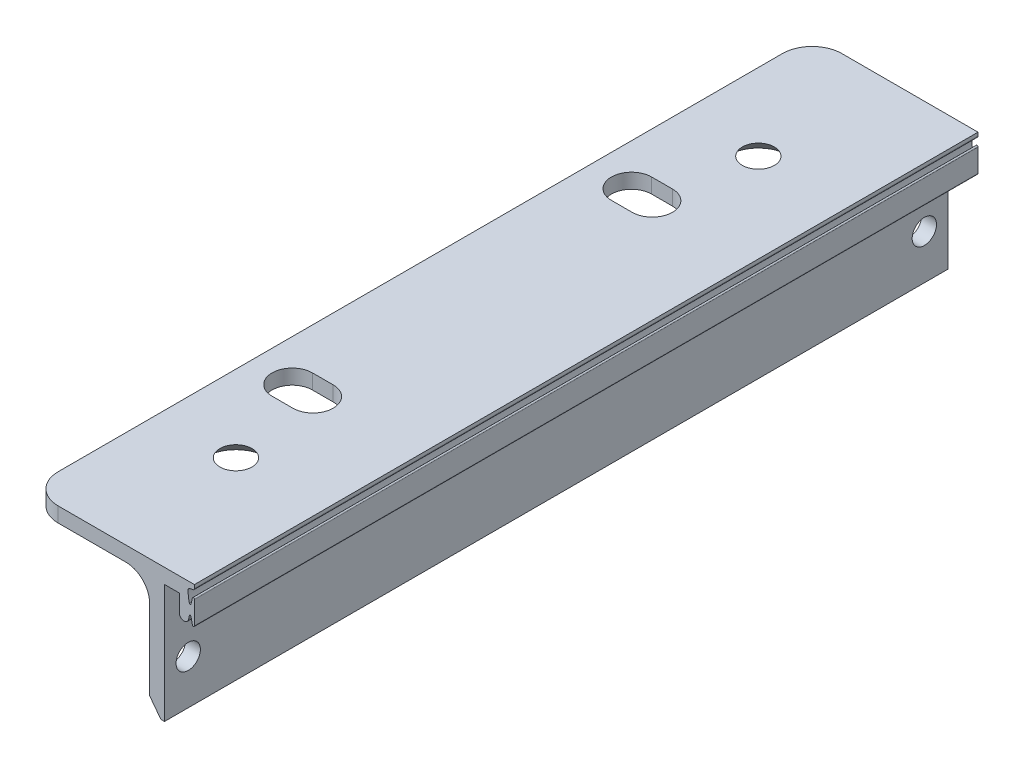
SolidWorks part; units mm, degrees
ref_plane "前视基准面" through (0, 0, 0) normal (0, 0, 1) x (1, 0, 0)
ref_plane "上视基准面" through (0, 0, 0) normal (0, 1, 0) x (1, 0, 0)
ref_plane "右视基准面" through (0, 0, 0) normal (1, 0, 0) x (0, 0, -1)
sketch "草图1" plane through (0, 0, 0) normal (0, 0, 1) x (1, 0, 0)
  line L0 (2329.984, -3290.1038) -> (2357.924, -3290.1038)
  line L1 (2329.984, -3292.6038) -> (2350.384, -3292.6038)
  line L2 (2352.884, -3292.6038) -> (2355.384, -3292.6038)
  line L3 (2350.384, -3292.6038) -> (2350.384, -3310.1038)
  line L4 (2352.884, -3292.6038) -> (2352.884, -3312.6038)
  line L6 (2357.924, -3290.1038) -> (2357.924, -3290.6784)
  line L8 (2329.984, -3290.1038) -> (2329.984, -3292.6038)
  line L9 (2355.384, -3292.6038) -> (2355.384, -3295.5205)
  line L10 (2352.884, -3312.6038) -> (2352.284, -3312.6038)
  line L11 (2350.384, -3310.1038) -> (2352.284, -3312.6038)
  line L14 (2356.9332, -3295.6826) -> (2357.0658, -3295.056)
  line L15 (2357.924, -3292.2796) -> (2357.924, -3296.128)
  line L17 (2357.1229, -3291.0635) -> (2357.672, -3290.9746)
  line L18 (2357.3611, -3295.0491) -> (2357.5873, -3296.1683)
  line L19 (2357.5884, -3292.2343) -> (2357.3601, -3293.2128)
  arc A0 (2356.8711, -3291.3476) -> (2357.0651, -3293.1963) centre (2363.3121, -3291.6063) ccw
  arc A1 (2357.672, -3290.9746) -> (2357.924, -3290.6784) centre (2357.624, -3290.6784) ccw
  arc A2 (2357.1229, -3291.0635) -> (2356.8711, -3291.3476) centre (2357.1709, -3291.3596) ccw
  arc A3 (2357.3611, -3295.0491) -> (2357.0658, -3295.056) centre (2357.214, -3295.0788) ccw
  arc A4 (2357.5873, -3296.1683) -> (2357.924, -3296.128) centre (2357.754, -3296.1346) ccw
  arc A5 (2357.0651, -3293.1963) -> (2357.3601, -3293.2128) centre (2357.214, -3293.1788) ccw
  arc A6 (2357.924, -3292.2796) -> (2357.5884, -3292.2343) centre (2357.754, -3292.2729) ccw
  arc A7 (2355.384, -3295.5205) -> (2356.9332, -3295.6826) centre (2356.1671, -3295.5205) ccw
  dimension "D1" = 20
  dimension "D2" = 0.6
  dimension "D3" = 2.5
  dimension "D4" = 20.4
  dimension "D5" = 127.235
extrude "凸台-拉伸1" add sketch "草图1" along normal mid plane 132
sketch "草图2" plane through (0, -3290.1038, 0) normal (0, 1, 0) x (1, 0, 0)
  line L0 (2338.734, 31.975) -> (2338.734, 25.175) construction
  line L2 (2357.924, 66) -> (2329.984, 66) construction
  line L3 (2357.924, 0) -> (2329.984, 0) construction
  line L4 (2357.924, -66) -> (2357.924, 66) construction
  line L5 (2329.984, -66) -> (2329.984, 66) construction
  line L6 (2340.484, -25.175) -> (2336.984, -25.175)
  line L7 (2340.484, -31.975) -> (2336.984, -31.975)
  line L9 (2340.484, 31.975) -> (2336.984, 31.975)
  line L10 (2340.484, 25.175) -> (2336.984, 25.175)
  arc A0 (2336.984, -31.975) -> (2336.984, -25.175) centre (2336.984, -28.575) cw
  arc A1 (2336.984, 31.975) -> (2336.984, 25.175) centre (2336.984, 28.575) ccw
  arc A2 (2340.484, -25.175) -> (2340.484, -31.975) centre (2340.484, -28.575) cw
  arc A4 (2340.484, 25.175) -> (2340.484, 31.975) centre (2340.484, 28.575) ccw
  dimension "D4" = 8.75
  dimension "D1" = 37.425
  dimension "D5" = 3.5
  dimension "D6" = 3.4
extrude "切除-拉伸1" cut sketch "草图2" against normal through all
sketch "草图3" plane through (2350.384, 0, 0) normal (-1, 0, 0) x (0, 0, 1)
  line L0 (-66, -3292.6038) -> (-66, -3310.1038) construction
  line L1 (66, -3290.1038) -> (-66, -3290.1038) construction
  line L2 (0, -3290.1038) -> (0, -3328.2905) construction
  circle A0 centre (-62, -3305.1038) radius 2.05
  circle A1 centre (62, -3305.1038) radius 2.05
  circle A2 centre (-62, -3325.1038) radius 2.05
  circle A3 centre (62, -3325.1038) radius 2.05
  dimension "D1" = 4.1
  dimension "D2" = 4
  dimension "D3" = 15
  dimension "D4" = 2
extrude "切除-拉伸2" cut sketch "草图3" against normal through all
fillet "圆角1" radius 5 2 edges at (2329.984, -3291.3538, -66) (2329.984, -3291.3538, 66)
hole_wizard "M5 平头机械螺钉的锥形沉头孔1" positions "草图5" profile "草图4" countersink size "M5" standard "Ansi Metric"
sketch "草图5" plane through (0, -3292.6038, 0) normal (0, -1, 0) x (-1, 0, 0)
  line L0 (-2329.984, 0) -> (-2357.9242, 0) construction
  line L1 (-2329.984, -61) -> (-2329.984, 61) construction
  line L2 (-2357.9242, 66) -> (-2357.9242, -66) construction
  point P0 (-2342.9242, -44)
  point P2 (-2342.9242, 44)
  dimension "D1" = 88
  dimension "D2" = 44
  dimension "D3" = 15
sketch "草图4" plane through (2342.9242, -3292.6038, 44) normal (1, 0, 0) x (0, 0, -1)
  line L0 (0, 0) -> (0, 2.5)
  line L1 (0, 2.5) -> (2.65, 2.5)
  line L2 (2.65, 2.5) -> (2.65, 2.55)
  line L3 (2.65, 2.55) -> (5.2, 0)
  line L5 (5.2, 0) -> (0, 0)
  line L6 (-2.65, 2.55) -> (-5.2, 0) construction
  line L11 (0, -6.35) -> (0, 107.95) construction
  dimension "通孔孔直径" = 5.3
  dimension "通孔孔深度" = 2.5
  dimension "近端锥形沉头孔直径" = 10.4
  dimension "近端锥形沉头孔角度" = 90
fillet "圆角2" radius 4 1 edges at (2350.384, -3292.6038, 0)
equation "\"切除-拉伸3\" = if ( \"D1@凸台-拉伸1\" = 176.45 , \"unsuppressed\" , \"suppressed\" )"
equation "\"切除-拉伸4\" = if ( \"D1@凸台-拉伸1\" = 220.9 , \"unsuppressed\" , \"suppressed\" )"
equation "\"切除-拉伸5\" = if ( \"D1@凸台-拉伸1\" = 265.35 , \"unsuppressed\" , \"suppressed\" )"
equation "\"切除-拉伸6\" = if ( \"D1@凸台-拉伸1\" = 265.35 , \"unsuppressed\" , \"suppressed\" )"
equation "\"切除-拉伸7\"= if ( \"D1@凸台-拉伸1\" = 265.35 , \"unsuppressed\" , \"suppressed\" )"
equation "\"切除-拉伸8\" = if ( \"D1@凸台-拉伸1\" = 132 , \"unsuppressed\" , \"suppressed\" )"
